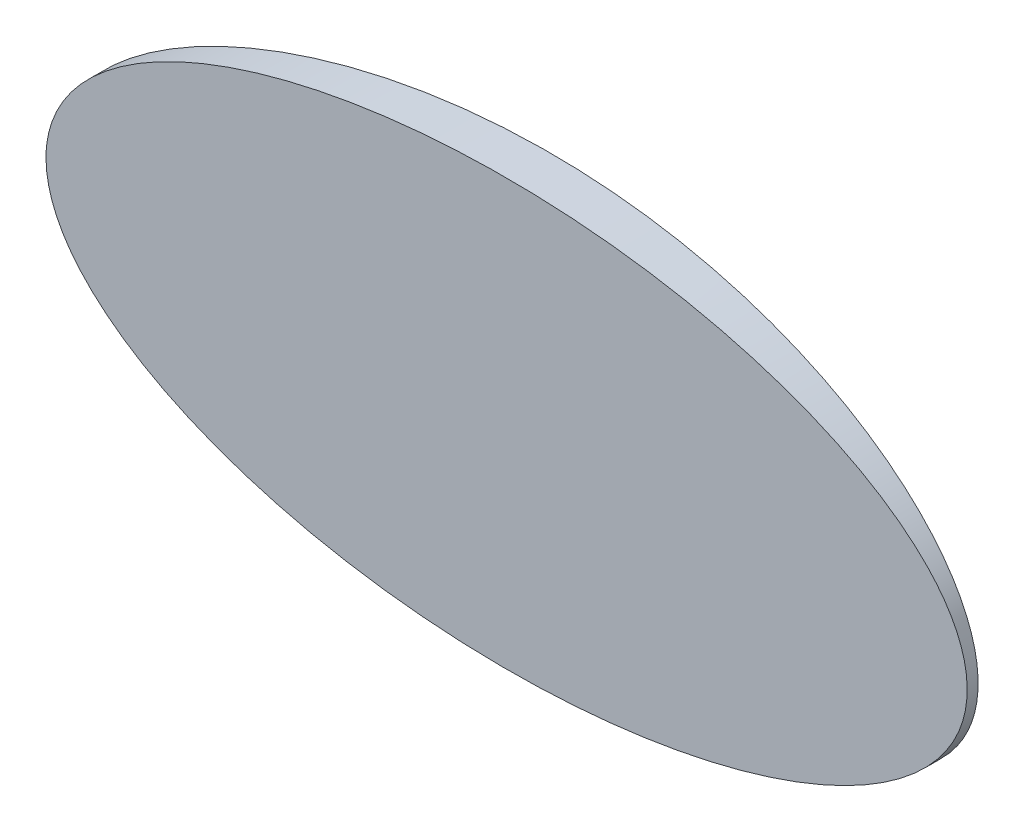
SolidWorks part; units mm, degrees
ref_plane "Ebene vorne" through (0, 0, 0) normal (0, 0, 1) x (1, 0, 0)
ref_plane "Ebene oben" through (0, 0, 0) normal (0, 1, 0) x (1, 0, 0)
ref_plane "Ebene rechts" through (0, 0, 0) normal (1, 0, 0) x (0, 0, -1)
sketch "Skizze1" plane through (0, 0, 0) normal (0, 0, 1) x (1, 0, 0)
  ellipse E0 centre (0, 0) end of major axis (-80.7958, 0) minor radius 37.3203
sketch "Skizze2" plane through (0, 0, 0) normal (1, 0, 0) x (0, 0, -1)
  circle A0 centre (126.6547, 0) radius 124.7407
surface "Oberfläche-Linear austragen1" sketch "Skizze2" parameters "D1"=195
extrude "Linear austragen1" add sketch "Skizze1" against normal up to surface (1.914 mm away)
delete or keep bodies "Körper-Löschen1" type delete bodies bodies 103
equation "\"LÄNGE\"=0"
equation "\"BREITE\"=0"
equation "\"HÖHE\"=0"
equation "\"DURCHMESSER\"=0"
equation "\"Stückzahl\"= 1"
